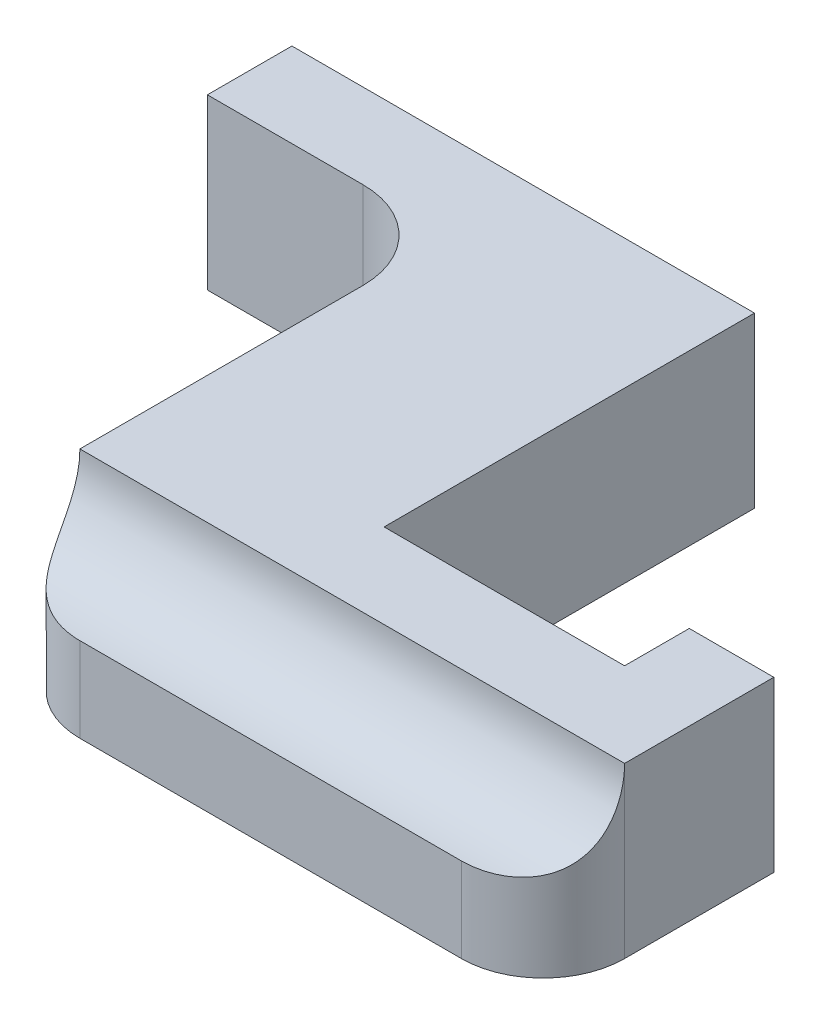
SolidWorks part; units mm, degrees
ref_plane "Front Plane" through (0, 0, 0) normal (0, 0, 1) x (1, 0, 0)
ref_plane "Top Plane" through (0, 0, 0) normal (0, 1, 0) x (1, 0, 0)
ref_plane "Right Plane" through (0, 0, 0) normal (1, 0, 0) x (0, 0, -1)
sketch "Sketch1" plane through (0, 0, 0) normal (0, 1, 0) x (1, 0, 0)
  line L0 (22.4272, -10.0029) -> (31.7672, -10.0029)
  line L1 (37.025, -15.2607) -> (37.025, -32.262)
  line L2 (41.9272, -37.1642) -> (64.8557, -37.1642)
  line L3 (69.7579, -32.262) -> (69.7579, -23.2958)
  line L4 (69.7579, -23.2958) -> (64.6779, -23.2958)
  line L5 (64.6779, -23.2958) -> (64.6779, -27.182)
  line L6 (64.6779, -27.182) -> (50.2253, -27.182)
  line L7 (50.2253, -27.182) -> (50.2253, -4.9229)
  line L8 (50.2253, -4.9229) -> (22.4272, -4.9229)
  line L9 (22.4272, -4.9229) -> (22.4272, -10.0029)
  line L10 (31.7672, -10.1807) -> (8.0246, -10.1807) construction
  line L11 (26.7067, -10.0029) -> (26.7067, -10.1807) construction
  line L15 (66.4305, -23.0418) -> (64.5001, -23.0418) construction
  line L16 (-34.4069, -4.9229) -> (-53.907, -4.9229) construction
  line L17 (64.5001, -27.182) -> (50.4031, -27.182) construction
  line L18 (50.4031, -20.7306) -> (64.5001, -20.7306) construction
  line L19 (64.5001, 0.9104) -> (64.5001, -23.88) construction
  line L20 (50.4031, 0.9104) -> (50.4031, -23.88) construction
  line L21 (50.4031, -25.2024) -> (64.5001, -25.2024) construction
  line L22 (64.5001, -25.2024) -> (64.6779, -25.2024) construction
  line L23 (50.4031, -25.2024) -> (50.2253, -25.2024) construction
  line L24 (36.8472, -27.182) -> (69.7579, -27.182) construction
  line L25 (36.8472, -15.2607) -> (36.8472, -32.262) construction
  line L26 (-48.827, -23.2958) -> (-81.7377, -23.2958) construction
  line L27 (-48.827, -32.262) -> (-48.827, -15.2607) construction
  line L28 (-81.7377, -19.6737) -> (-81.7377, -32.262) construction
  line L29 (-43.747, -10.0029) -> (-34.4069, -10.0029) construction
  arc A0 (31.7672, -10.0029) -> (37.025, -15.2607) centre (31.7672, -15.2607) cw
  arc A1 (37.025, -32.262) -> (41.9272, -37.1642) centre (41.9272, -32.262) ccw
  arc A2 (64.8557, -37.1642) -> (69.7579, -32.262) centre (64.8557, -32.262) ccw
  arc A3 (36.8472, -15.2607) -> (31.7672, -10.1807) centre (31.7672, -15.2607) ccw construction
  arc A4 (36.8472, -32.262) -> (41.9272, -37.342) centre (41.9272, -32.262) ccw construction
  dimension "D1" = 0.1778
  dimension "D2" = 0.1778
  dimension "D5" = 5.08
  dimension "D6" = 0.254
extrude "Boss-Extrude1" add sketch "Sketch1" against normal up to surface (10.16 mm away)
sketch "Sketch2" plane through (69.7579, 0, 0) normal (1, 0, 0) x (0, 0, -1)
  line L0 (-37.1642, -5.0769) -> (-37.342, 0)
  line L1 (-37.342, 0) -> (-32.262, 0)
  arc A0 (-37.1642, -5.0769) -> (-32.262, 0) centre (-37.342, 0) ccw construction
  arc A1 (-37.1642, -5.0769) -> (-32.262, 0) centre (-37.342, 0) ccw
extrude "Cut-Extrude1" cut sketch "Sketch2" against normal through all
